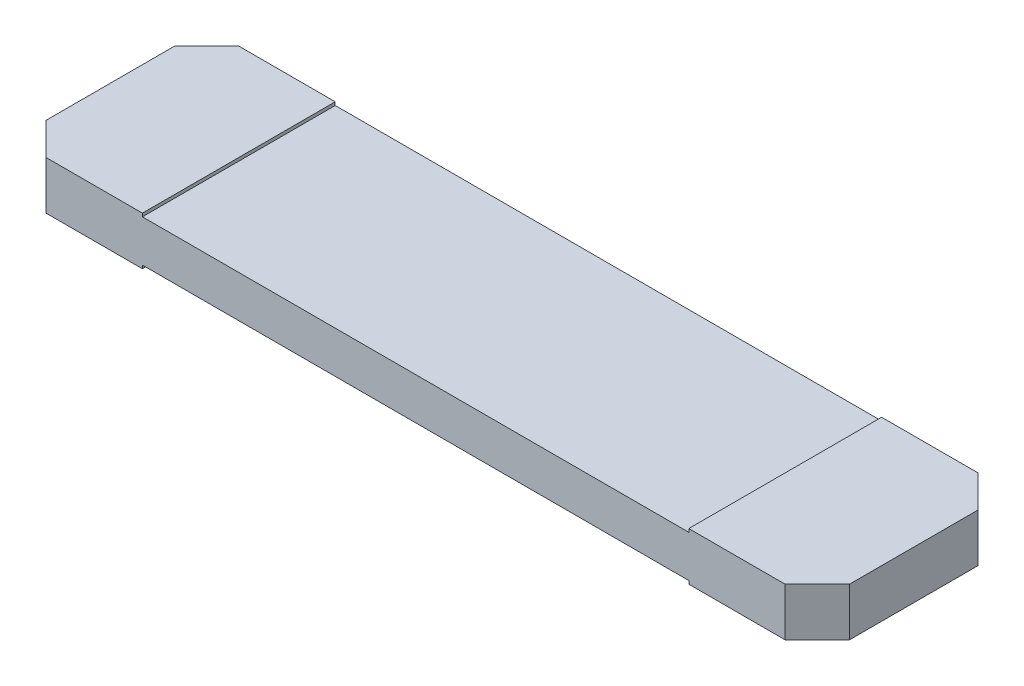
SolidWorks part; units mm, degrees
ref_plane "Plan de face" through (0, 0, 0) normal (0, 0, 1) x (1, 0, 0)
ref_plane "Plan de dessus" through (0, 0, 0) normal (0, 1, 0) x (1, 0, 0)
ref_plane "Plan de droite" through (0, 0, 0) normal (1, 0, 0) x (0, 0, -1)
sketch "Esquisse1" plane through (0, 0, 0) normal (0, 1, 0) x (1, 0, 0)
  line L0 (-12.5, 2) -> (-11.5, 3)
  line L1 (-11.5, -3) -> (11.5, -3)
  line L2 (-12.5, -2) -> (-12.5, 2)
  line L3 (-11.5, 3) -> (11.5, 3)
  line L4 (12.5, -2) -> (12.5, 2)
  line L5 (-12.5, -2) -> (-11.5, -3)
  line L6 (11.5, -3) -> (12.5, -2)
  line L7 (11.5, 3) -> (12.5, 2)
  point P0 (-12.5, -3)
  point P1 (12.5, 3)
  point P2 (-12.5, 3)
  point P3 (12.5, -3)
  dimension "D1" = 25
  dimension "D2" = 12.5
  dimension "D3" = 6
  dimension "D6" = 1
  dimension "D7" = 1
  dimension "D8" = 1
  dimension "D9" = 1
  dimension "D4" = 3
extrude "Extrusion1" add sketch "Esquisse1" along normal mid plane 1.5
sketch "Esquisse2" plane through (0, 0, 0) normal (0, 0, 1) x (1, 0, 0)
  line L0 (-11.5, 0.75) -> (11.5, 0.75) construction
  line L1 (-8.5, 2.65) -> (8.5, 2.65)
  line L2 (-8.5, 2.65) -> (-8.5, 0.65)
  line L3 (-8.5, 0.65) -> (8.5, 0.65)
  line L4 (8.5, 2.65) -> (8.5, 0.65)
  line L5 (8.5, -2.65) -> (-8.5, -2.65)
  line L6 (8.5, -2.65) -> (8.5, -0.65)
  line L7 (8.5, -0.65) -> (-8.5, -0.65)
  line L8 (-8.5, -2.65) -> (-8.5, -0.65)
  line L9 (-11.5, -0.75) -> (11.5, -0.75) construction
  line L10 (-12.5, 0.75) -> (-12.5, -0.75) construction
  line L11 (12.5, 0.75) -> (12.5, -0.75) construction
  dimension "D1" = 0.1
  dimension "D2" = 0.1
  dimension "D3" = 2
  dimension "D4" = 4
  dimension "D5" = 4
extrude "Enlèv. mat.-Extru.1" cut sketch "Esquisse2" against normal mid plane 21.5
